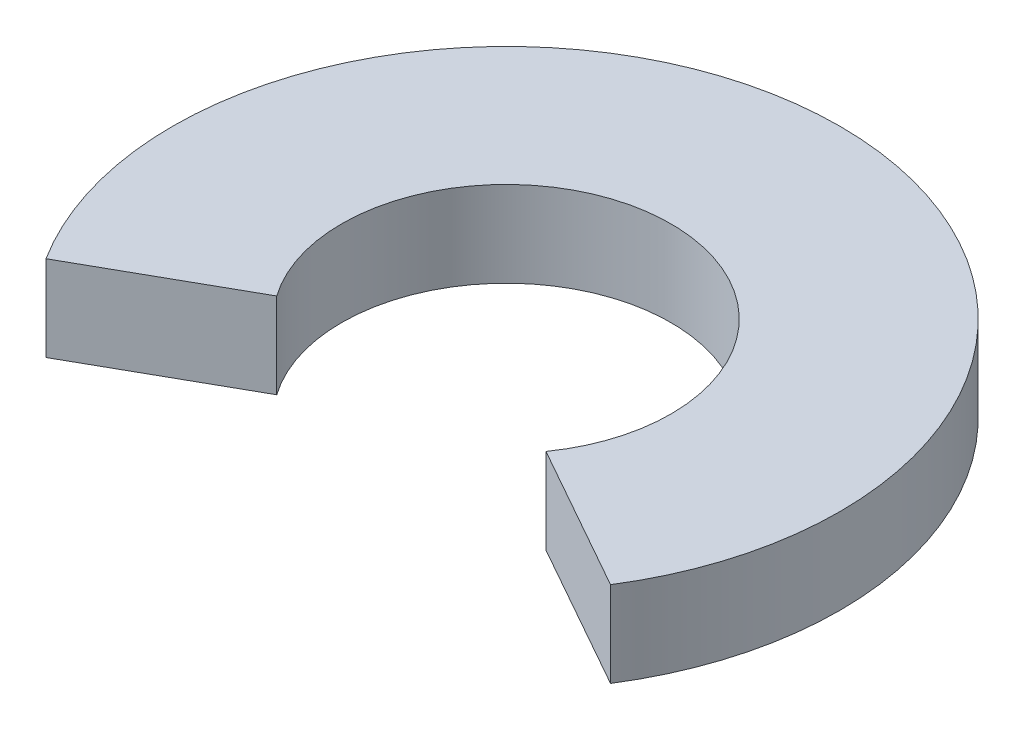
SolidWorks part; units mm, degrees
ref_plane "Front Plane" through (0, 0, 0) normal (0, 0, 1) x (1, 0, 0)
ref_plane "Top Plane" through (0, 0, 0) normal (0, 1, 0) x (1, 0, 0)
ref_plane "Right Plane" through (0, 0, 0) normal (1, 0, 0) x (0, 0, -1)
sketch "Sketch1" plane through (0, 0, 0) normal (0, 1, 0) x (1, 0, 0)
  circle A0 centre (0, 0) radius 99.06
  circle A1 centre (0, 0) radius 48.895
  arc A4 (75.8692, -63.6926) -> (-75.8692, -63.6926) centre (0, 0) ccw construction
  dimension "D1" = 97.79
extrude "Boss-Extrude1" add sketch "Sketch1" along normal blind 25.4
sketch "Sketch3" plane through (0, 0, 0) normal (0, -1, 0) x (1, 0, 0)
  circle A0 centre (0, 0) radius 97.155
  circle A1 centre (0, 0) radius 59.655
  arc A2 (-76.669, 59.6737) -> (76.669, 59.6737) centre (0, 0) ccw construction
  arc A3 (-51.0249, 30.906) -> (51.0249, 30.906) centre (0, 0) ccw construction
extrude "Cut-Extrude2" cut sketch "Sketch3" against normal offset from surface (21.59 mm away) 3.81
sketch "Sketch2" plane through (0, 25.4, -29.7949) normal (0, 1, 0) x (1, 0, 0)
  line L0 (-42.0367, -54.7676) -> (-85.759, -79.3759)
  line L1 (42.0367, -54.7676) -> (85.759, -79.3759)
  line L2 (0, -29.7949) -> (0, -98.2588) construction
  line L5 (-106.4957, -91.0472) -> (-12.2139, -37.9823) construction
  circle A0 centre (-79.9764, -65.5068) radius 9.25 construction
  circle A1 centre (-64.0175, -56.5246) radius 9.25 construction
  circle A2 centre (0, -29.7949) radius 99.06 construction
  arc A3 (-85.759, -79.3759) -> (85.759, -79.3759) centre (0, -29.7949) ccw
  arc A4 (-42.0367, -54.7676) -> (42.0367, -54.7676) centre (0, -29.7949) ccw
  circle A6 centre (0, -29.7949) radius 48.895 construction
extrude "Cut-Extrude1" cut sketch "Sketch2" against normal through all and the other way through all
sketch "Sketch4" plane through (0, 25.4, 0) normal (0, 1, 0) x (1, 0, 0)
  line L0 (-85.759, -49.581) -> (-42.0367, -24.9727)
  line L3 (-83.788, -52.8437) -> (-39.9603, -28.1761)
  line L4 (42.0367, -24.9727) -> (85.759, -49.581)
  line L7 (39.9603, -28.1761) -> (83.788, -52.8437)
  line L8 (85.759, -49.581) -> (42.0367, -24.9727) construction
  arc A2 (-85.759, -49.581) -> (-83.788, -52.8437) centre (0, 0) ccw
  arc A4 (85.759, -49.581) -> (-85.759, -49.581) centre (0, 0) ccw construction
  arc A5 (85.759, -49.581) -> (83.788, -52.8437) centre (0, 0) cw
  arc A6 (-42.0367, -24.9727) -> (-39.9603, -28.1761) centre (0, 0) ccw
  arc A7 (42.0367, -24.9727) -> (-42.0367, -24.9727) centre (0, 0) ccw construction
  arc A8 (42.0367, -24.9727) -> (39.9603, -28.1761) centre (0, 0) cw
  dimension "D1" = 3.81
  dimension "D2" = 3.81
extrude "Boss-Extrude2" add sketch "Sketch4" against normal up to surface (25.4 mm away)
